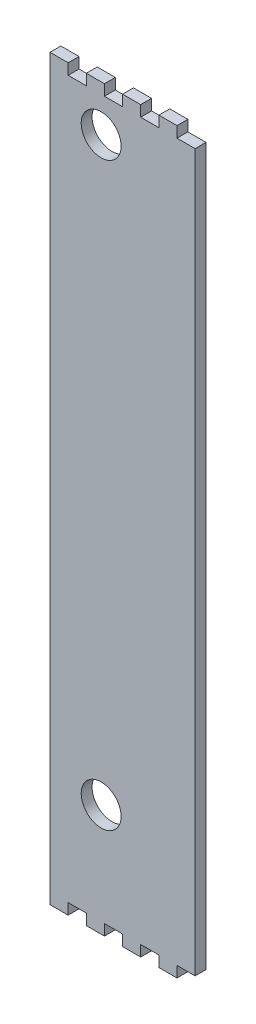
SolidWorks part; units mm, degrees
ref_plane "Piano frontale" through (0, 0, 0) normal (0, 0, 1) x (1, 0, 0)
ref_plane "Piano superiore" through (0, 0, 0) normal (0, 1, 0) x (1, 0, 0)
ref_plane "Piano destro" through (0, 0, 0) normal (1, 0, 0) x (0, 0, -1)
sketch "Schizzo1" plane through (0, 0, 0) normal (0, 0, 1) x (1, 0, 0)
  line L0 (-20, 203.5) -> (-20, 197.5)
  line L1 (-40, 203.5) -> (-30, 203.5)
  line L2 (-40, 203.5) -> (-40, -203.5)
  line L3 (-40, -203.5) -> (-30, -203.5)
  line L4 (40, 197.5) -> (40, -197.5)
  line L5 (0, 203.5) -> (10, 203.5)
  line L6 (-30, 203.5) -> (-30, 197.5)
  line L7 (-30, 197.5) -> (-20, 197.5)
  line L8 (-20, 203.5) -> (-20, 197.5)
  line L9 (-10, 203.5) -> (-10, 197.5)
  line L10 (-20, 197.5) -> (-10, 197.5)
  line L11 (-10, 203.5) -> (-10, 197.5)
  line L12 (0, 203.5) -> (0, 197.5)
  line L13 (-10, 197.5) -> (0, 197.5)
  line L14 (0, 203.5) -> (0, 197.5)
  line L15 (10, 203.5) -> (10, 197.5)
  line L16 (0, 197.5) -> (10, 197.5)
  line L17 (10, 203.5) -> (10, 197.5)
  line L18 (20, 203.5) -> (20, 197.5)
  line L19 (10, 197.5) -> (20, 197.5)
  line L20 (20, 203.5) -> (20, 197.5)
  line L21 (30, 203.5) -> (30, 197.5)
  line L22 (20, 197.5) -> (30, 197.5)
  line L23 (30, 203.5) -> (30, 197.5)
  line L24 (-40, 0) -> (40, 0) construction
  line L25 (30, 197.5) -> (40, 197.5)
  line L26 (-20, 203.5) -> (-10, 203.5)
  line L27 (20, 203.5) -> (30, 203.5)
  line L28 (40, 203.5) -> (40, 197.5)
  line L29 (30, -197.5) -> (40, -197.5)
  line L30 (30, -203.5) -> (30, -197.5)
  line L31 (20, -203.5) -> (20, -197.5)
  line L32 (10, -197.5) -> (20, -197.5)
  line L33 (10, -203.5) -> (10, -197.5)
  line L34 (0, -203.5) -> (0, -197.5)
  line L35 (-10, -197.5) -> (0, -197.5)
  line L36 (-10, -203.5) -> (-10, -197.5)
  line L37 (-20, -203.5) -> (-20, -197.5)
  line L38 (-30, -197.5) -> (-20, -197.5)
  line L39 (-30, -203.5) -> (-30, -197.5)
  line L40 (-20, -203.5) -> (-10, -203.5)
  line L41 (0, -203.5) -> (10, -203.5)
  line L42 (20, -203.5) -> (30, -203.5)
  dimension "D1" = 407
  dimension "D3" = 10
  dimension "D4" = 6
  dimension "D5" = 7
extrude "Estrusione-Estrusione1" add sketch "Schizzo1" along normal blind 6
sketch "Schizzo2" plane through (0, 0, 0) normal (0, 0, -1) x (-1, 0, 0)
  circle A0 centre (11.8063, 178.2212) radius 11
  circle A1 centre (11.8063, -141.7788) radius 11
  dimension "D1" = 22
  dimension "D2" = 22
extrude "Taglio-Estrusione1" cut sketch "Schizzo2" against normal through all
